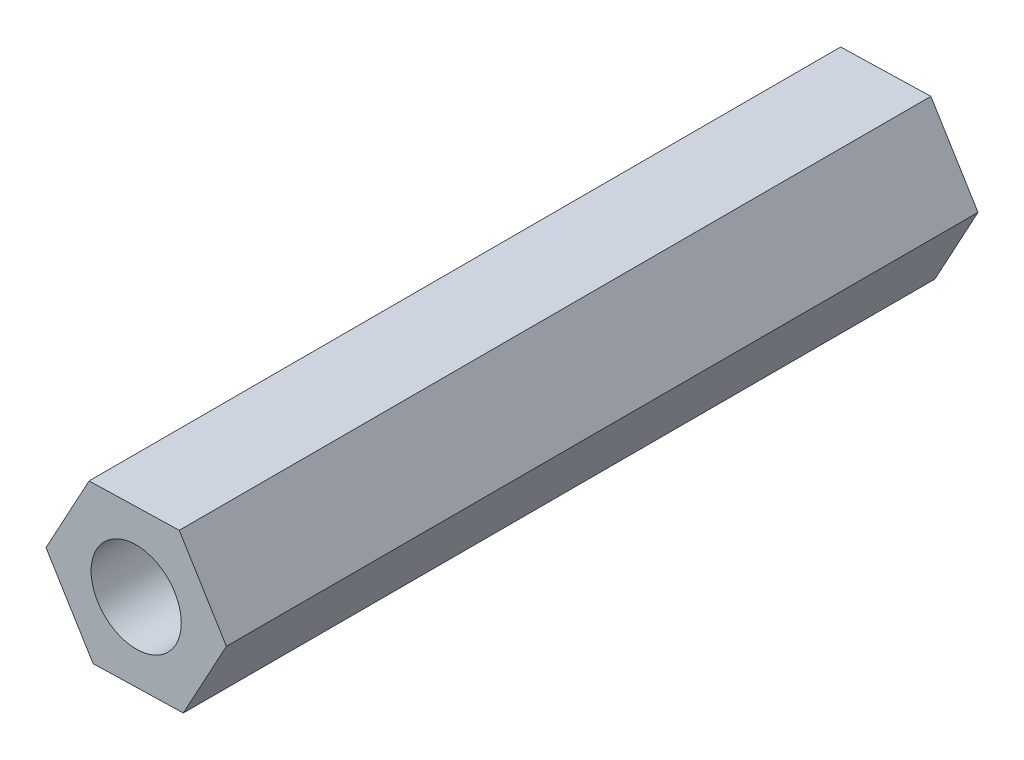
SolidWorks part; units mm, degrees
ref_plane "Plan de face" through (0, 0, 0) normal (0, 0, 1) x (1, 0, 0)
ref_plane "Plan de dessus" through (0, 0, 0) normal (0, 1, 0) x (1, 0, 0)
ref_plane "Plan de droite" through (0, 0, 0) normal (1, 0, 0) x (0, 0, -1)
sketch "Esquisse1" plane through (0, 0, 0) normal (0, 0, 1) x (1, 0, 0)
  line L1 (1.5675, -2.5591) -> (3, 0.078)
  line L2 (3, 0.078) -> (1.4325, 2.6371)
  line L3 (1.4325, 2.6371) -> (-1.5675, 2.5591)
  line L4 (-1.5675, 2.5591) -> (-3, -0.078)
  line L5 (-3, -0.078) -> (-1.4325, -2.6371)
  line L6 (-1.4325, -2.6371) -> (1.5675, -2.5591)
  circle A0 centre (0, 0) radius 2.599 construction
  circle A1 centre (0, 0) radius 1.5
  dimension "D2" = 3
  dimension "D1" = 6
extrude "Boss.-Extru.1" add sketch "Esquisse1" along normal blind 25
